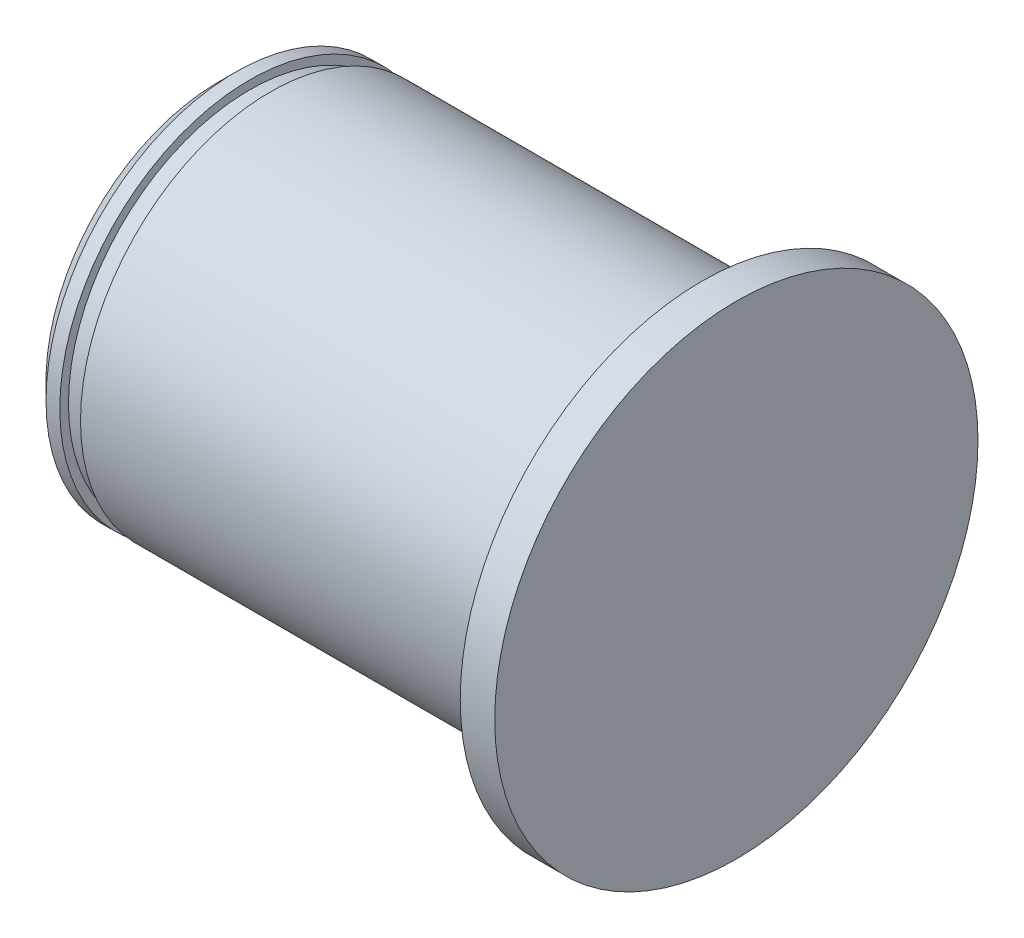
SolidWorks part; units mm, degrees
ref_plane "Plan de face" through (0, 0, 0) normal (0, 0, 1) x (1, 0, 0)
ref_plane "Plan de dessus" through (0, 0, 0) normal (0, 1, 0) x (1, 0, 0)
ref_plane "Plan de droite" through (0, 0, 0) normal (1, 0, 0) x (0, 0, -1)
sketch "Esquisse1" plane through (0, 0, 0) normal (0, 0, 1) x (1, 0, 0)
  line L0 (0, 0) -> (0, 14)
  line L1 (0, 14) -> (-2, 14)
  line L2 (-2, 14) -> (-2, 11)
  line L3 (-2, 11) -> (-27, 11)
  line L4 (-27, 11) -> (-27, 10.5)
  line L5 (-27, 10.5) -> (-28.2, 10.5)
  line L6 (-28.2, 10.5) -> (-28.2, 11)
  line L7 (-28.2, 11) -> (-30, 11)
  line L8 (-30, 11) -> (-30, 0)
  line L9 (-30, 0) -> (0, 0)
  dimension "D1" = 14
  dimension "D2" = 2
  dimension "D3" = 11
  dimension "D4" = 10.5
  dimension "D5" = 11
  dimension "D6" = 30
  dimension "D7" = 27
  dimension "D8" = 1.2
revolve "Révolution1" add sketch "Esquisse1" angle 360 about L9
chamfer "Chanfrein1" distance 1 angle 45 1 edges at (-30, 0, 11)
